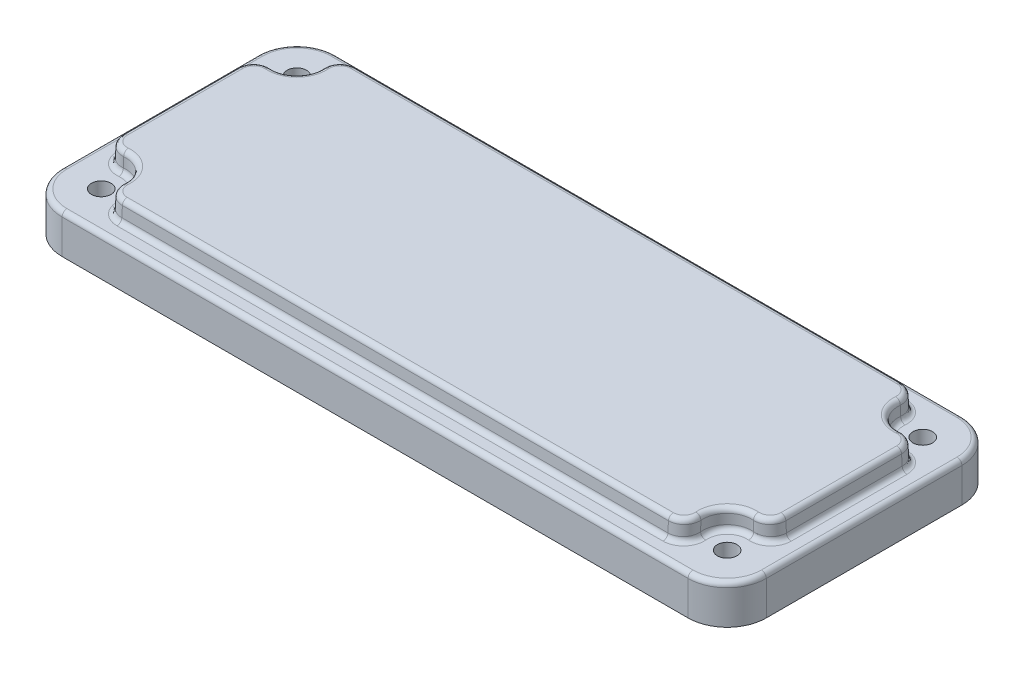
SolidWorks part; units mm, degrees
ref_plane "Front" through (0, 0, 0) normal (0, 0, 1) x (1, 0, 0)
ref_plane "Top" through (0, 0, 0) normal (0, 1, 0) x (1, 0, 0)
ref_plane "Right" through (0, 0, 0) normal (1, 0, 0) x (0, 0, -1)
sketch "Sketch1" plane through (0, 0, 0) normal (0, 1, 0) x (1, 0, 0)
  line L0 (-50.8, 22.225) -> (50.8, 22.225)
  line L1 (-57.15, 15.875) -> (-57.15, -15.875)
  line L2 (50.8, -22.225) -> (-50.8, -22.225)
  line L3 (57.15, -15.875) -> (57.15, 15.875)
  line L4 (-50.8, -15.875) -> (50.8, 15.875) construction
  arc A0 (-57.15, -15.875) -> (-50.8, -22.225) centre (-50.8, -15.875) ccw
  arc A1 (57.15, -15.875) -> (50.8, -22.225) centre (50.8, -15.875) cw
  arc A2 (50.8, 22.225) -> (57.15, 15.875) centre (50.8, 15.875) cw
  arc A3 (-50.8, 22.225) -> (-57.15, 15.875) centre (-50.8, 15.875) ccw
  dimension "D1" = 114.3
  dimension "D2" = 44.45
  dimension "D4" = 6.35
extrude "Base-Extrude" add sketch "Sketch1" along normal blind 6.35
sketch "Sketch2" plane through (0, 6.35, 0) normal (0, 1, 0) x (-1, 0, 0)
  line L4 (50.8, 19.05) -> (-50.8, 19.05)
  line L5 (-53.975, 15.875) -> (-53.975, -15.875)
  line L6 (-50.8, -19.05) -> (50.8, -19.05)
  line L7 (53.975, -15.875) -> (53.975, 15.875)
  line L8 (50.8, 19.05) -> (-50.8, 19.05)
  line L9 (-53.975, 15.875) -> (-53.975, -15.875)
  line L10 (-50.8, -19.05) -> (50.8, -19.05)
  line L11 (53.975, -15.875) -> (53.975, 15.875)
  arc A4 (53.975, 15.875) -> (50.8, 19.05) centre (50.8, 15.875) ccw
  arc A5 (53.975, 15.875) -> (50.8, 19.05) centre (50.8, 15.875) ccw
  arc A6 (-50.8, 19.05) -> (-53.975, 15.875) centre (-50.8, 15.875) ccw
  arc A7 (-50.8, 19.05) -> (-53.975, 15.875) centre (-50.8, 15.875) ccw
  arc A8 (-53.975, -15.875) -> (-50.8, -19.05) centre (-50.8, -15.875) ccw
  arc A9 (-53.975, -15.875) -> (-50.8, -19.05) centre (-50.8, -15.875) ccw
  arc A10 (50.8, -19.05) -> (53.975, -15.875) centre (50.8, -15.875) ccw
  arc A11 (50.8, -19.05) -> (53.975, -15.875) centre (50.8, -15.875) ccw
  dimension "D1" = 3.175
extrude "Boss-Extrude1" add sketch "Sketch2" along normal blind 3.175 draft 3
sketch "Sketch3" plane through (0, 9.525, 0) normal (0, 1, 0) x (-1, 0, 0)
  circle A0 centre (-50.8, 15.875) radius 3.9687
  dimension "D1" = 7.9375
extrude "Cut-Extrude1" cut sketch "Sketch3" against normal up to surface (3.175 mm away)
sketch "Sketch4" plane through (0, 6.35, 0) normal (0, 1, 0) x (-1, 0, 0)
  circle A0 centre (-50.8, 15.875) radius 1.5875
  dimension "D1" = 3.175
extrude "Cut-Extrude2" cut sketch "Sketch4" against normal through all
mirror "Mirror1" about plane through (0, 0, 0) normal (0, 0, 1) of "Cut-Extrude2", "Cut-Extrude1"
mirror "Mirror2" about plane through (0, 0, 0) normal (1, 0, 0) of "Mirror1", "Cut-Extrude1", "Cut-Extrude2"
fillet "Fillet1" radius 2.54 8 edges at (53.8935, 7.9044, 13.3888) (48.3138, 7.9044, 18.9685) (53.8935, 7.9044, -13.3888) (48.3138, 7.9044, -18.9685) (-53.8935, 7.9044, -13.3888) (-48.3138, 7.9044, -18.9685) (-48.3138, 7.9044, 18.9685) (-53.8935, 7.9044, 13.3888)
fillet "Fillet2" radius 0.7937 56 edges at (55.2901, 6.35, 20.3651) (0, 6.35, 19.05) (0, 9.525, 18.8836) (-44.315, 7.9366, 18.9668) (44.315, 7.9366, 18.9668) (-53.8086, 9.525, 0) (-47.9937, 9.525, 13.0687) (47.9937, 9.525, 13.0687) (53.8086, 9.525, 0) (47.9937, 9.525, -13.0687) (0, 9.525, -18.8836) (-47.9937, 9.525, -13.0687) (-46.3986, 9.525, 17.785) (-53.2526, 9.525, 10.9683) (-52.71, 9.525, -11.4736) (-45.8933, 9.525, -18.3276) (46.3986, 9.525, -17.785) (53.2526, 9.525, -10.9683) (52.71, 9.525, 11.4736) (45.8933, 9.525, 18.3276) (47.9937, 6.35, 13.0687) (51.1344, 7.9366, 11.9204) (46.8454, 7.9366, 16.2094) (53.975, 6.35, 0) (53.8918, 7.9366, -9.39) (53.8918, 7.9366, 9.39) (47.9937, 6.35, -13.0687) (46.8454, 7.9366, -16.2094) (51.1344, 7.9366, -11.9204) (0, 6.35, -19.05) (-44.315, 7.9366, -18.9668) (44.315, 7.9366, -18.9668) (-47.9937, 6.35, -13.0687) (-51.1344, 7.9366, -11.9204) (-46.8454, 7.9366, -16.2094) (-53.975, 6.35, 0) (-53.8918, 7.9366, 9.39) (-53.8918, 7.9366, -9.39) (57.15, 6.35, 0) (-47.9937, 6.35, 13.0687) (-46.8454, 7.9366, 16.2094) (-51.1344, 7.9366, 11.9204) (46.2919, 6.35, 18.1127) (53.2408, 6.35, 11.1827) (53.0648, 6.35, -11.3446) (46.1444, 6.35, -18.2787) (-46.2625, 6.35, -18.1482) (-53.2213, 6.35, -11.2022) (-53.0383, 6.35, 11.3664) (-46.1066, 6.35, 18.3169) (55.2901, 6.35, -20.3651) (0, 6.35, -22.225) (-55.2901, 6.35, -20.3651) (-57.15, 6.35, 0) (-55.2901, 6.35, 20.3651) (0, 6.35, 22.225)
sketch "Sketch5" plane through (0, 0, 0) normal (0, -1, 0) x (1, 0, 0)
  line L0 (-44.45, 15.875) -> (44.45, 15.875)
  line L1 (-44.45, 15.875) -> (-44.45, -15.875)
  line L2 (44.45, -15.875) -> (-44.45, -15.875)
  line L3 (44.45, -15.875) -> (44.45, 15.875)
  line L4 (50.8, 22.225) -> (-50.8, 22.225) construction
  line L5 (57.15, 15.875) -> (57.15, -15.875) construction
  line L6 (-57.15, -15.875) -> (-57.15, 15.875) construction
  line L7 (-50.8, -22.225) -> (50.8, -22.225) construction
  dimension "D1" = 6.35
  dimension "D2" = 12.7
  dimension "D3" = 12.7
  dimension "D4" = 6.35
extrude "Cut-Extrude3" cut sketch "Sketch5" against normal blind 6.35 draft 3
fillet "Fillet3" radius 6.35 4 edges at (-44.2836, 3.175, -15.7086) (-44.2836, 3.175, 15.7086) (44.2836, 3.175, 15.7086) (44.2836, 3.175, -15.7086)
fillet "Fillet4" radius 3.175 8 edges at (-44.1172, 6.35, 0) (0, 6.35, 15.5422) (0, 6.35, -15.5422) (44.1172, 6.35, 0) (-42.2609, 6.35, -13.6859) (42.2609, 6.35, 13.6859) (42.2609, 6.35, -13.6859) (-42.2609, 6.35, 13.6859)
sketch "Sketch6" plane through (0, 9.525, 0) normal (0, 1, 0) x (-1, 0, 0)
  circle A0 centre (0, 0) radius 3.175
  dimension "Diam" = 6.35
extrude "Boss-Extrude2" add sketch "Sketch6" along normal blind 12.7
sketch "Sketch7" plane through (0, 0, 0) normal (1, 0, 0) x (0, 0, -1)
  line L0 (-21.4313, 30.1625) -> (15.875, 30.1625) construction
  line L1 (0, 22.225) -> (0, 9.525) construction
  line L2 (3.175, 22.225) -> (-3.175, 22.225) construction
  circle A0 centre (0, 22.225) radius 3.175
  dimension "D1" = 9.525
revolve "Boss-Revolve1" add sketch "Sketch7" angle 360 about L0
fillet "Fillet5" radius 2.032
